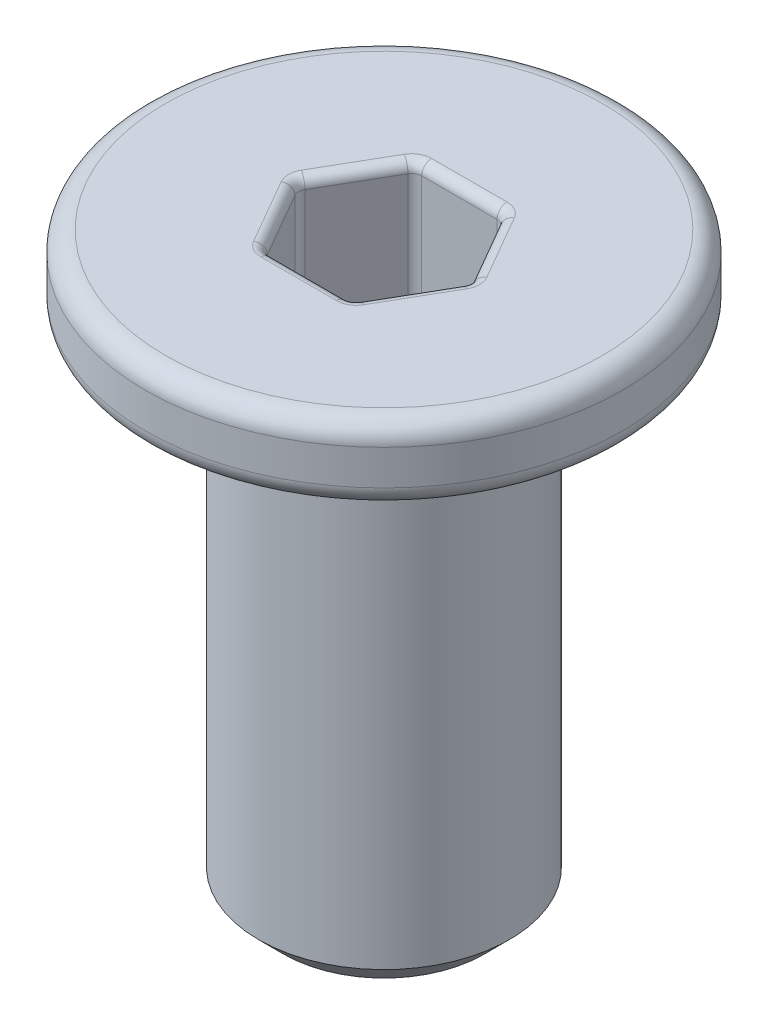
SolidWorks part; units mm, degrees
ref_plane "Plan1" through (0, 0, 0) normal (0, 0, 1) x (1, 0, 0)
ref_plane "Plan2" through (0, 0, 0) normal (0, 1, 0) x (1, 0, 0)
ref_plane "Plan3" through (0, 0, 0) normal (1, 0, 0) x (0, 0, -1)
sketch "Esquisse1" plane through (0, 0, 0) normal (0, 0, 1) x (1, 0, 0)
  line L0 (0, 16.5) -> (0, -15.5) construction
  line L1 (-2.5, 0) -> (-4.35, 0)
  line L2 (-4.35, 1.5) -> (0, 1.5)
  line L3 (-2.5, 0) -> (-2.5, -9.5)
  line L4 (-2.5, -9.5) -> (-2, -10)
  line L5 (-2, -10) -> (0, -10)
  line L6 (0, -10) -> (0, 1.5)
  line L7 (-4.75, 1.1) -> (-4.75, 0.4)
  arc A0 (-4.35, 1.5) -> (-4.75, 1.1) centre (-4.35, 1.1) ccw
  arc A1 (-4.35, 0) -> (-4.75, 0.4) centre (-4.35, 0.4) cw
  dimension "D1" = 0.4
  dimension "D2" = 2.5
  dimension "D3" = 4.75
  dimension "D4" = 1.5
  dimension "D5" = 10
  dimension "D6" = 45
  dimension "D7" = 0.5
revolve "Vis" add sketch "Esquisse1" angle 360 about L0
sketch "Esquisse2" plane through (0, 1.5, 0) normal (0, 1, 0) x (-1, 0, 0)
  line L0 (-2, 0) -> (2.5, 0) construction
  line L1 (0, -2.5) -> (0, 3) construction
  line L2 (0.866, -1.5) -> (-0.866, -1.5)
  line L3 (-0.866, -1.5) -> (-1.7321, 0)
  line L4 (-0.866, 1.5) -> (-1.7321, 0)
  line L5 (0.866, 1.5) -> (-0.866, 1.5)
  line L6 (0.866, 1.5) -> (1.7321, 0)
  line L7 (0.866, -1.5) -> (1.7321, 0)
  point P13 (0, 1.5)
  point P15 (0, -1.5)
  dimension "D1" = 60
  dimension "D2" = 3
  dimension "D3" = 1.7321
  dimension "D4" = 1.5
extrude "CHC" cut sketch "Esquisse2" against normal blind 5
fillet "Congé1" radius 0.2
